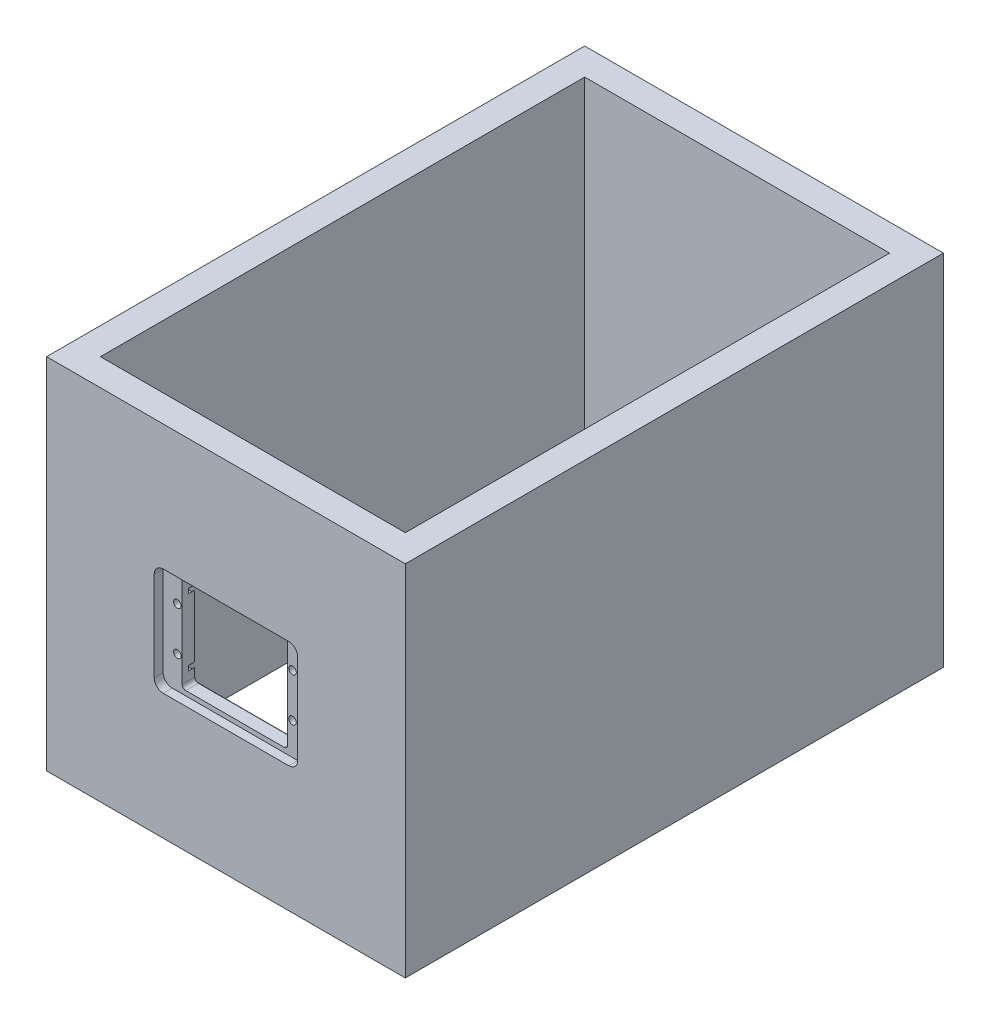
SolidWorks part; units mm, degrees
ref_plane "前基準面" through (0, 0, 0) normal (0, 0, 1) x (1, 0, 0)
ref_plane "上基準面" through (0, 0, 0) normal (0, 1, 0) x (1, 0, 0)
ref_plane "右基準面" through (0, 0, 0) normal (1, 0, 0) x (0, 0, -1)
sketch "草圖1" plane through (0, 0, 0) normal (0, 0, 1) x (1, 0, 0)
  line L1 (-100, 100) -> (100, 100)
  line L2 (-100, 100) -> (-100, -100)
  line L3 (-100, -100) -> (100, -100)
  line L4 (100, 100) -> (100, -100)
  line L5 (-100, 100) -> (100, -100) construction
  line L6 (-100, -100) -> (100, 100) construction
  point P0 (0, 0)
  dimension "D1" = 200
  dimension "D2" = 200
extrude "填料-伸長1" add sketch "草圖1" along normal blind 300
sketch "草圖2" plane through (0, -100, 0) normal (0, -1, 0) x (1, 0, 0)
  line L0 (-100, 0) -> (100, 0) construction
  line L1 (-85, 285) -> (85, 285)
  line L2 (-85, 285) -> (-85, 15)
  line L3 (-85, 15) -> (85, 15)
  line L4 (85, 285) -> (85, 15)
  line L5 (-85, 285) -> (85, 15) construction
  line L6 (-85, 15) -> (85, 285) construction
  line L7 (-100, 300) -> (100, 300) construction
  line L8 (-100, 300) -> (-100, 0) construction
  line L9 (100, 300) -> (100, 0) construction
  point P0 (0, 150)
  dimension "D1" = 15
  dimension "D2" = 15
  dimension "D3" = 15
  dimension "D4" = 15
extrude "除料-伸長1" cut sketch "草圖2" against normal through all
sketch "草圖3" plane through (0, 0, 0) normal (0, 0, -1) x (-1, 0, 0)
  circle A0 centre (0, 0) radius 7.5
  dimension "D1" = 15
extrude "除料-伸長2" cut sketch "草圖3" against normal up to next
sketch "草圖4" plane through (0, 0, 285) normal (0, 0, -1) x (-1, 0, 0)
  line L0 (0, 26.9) -> (0, -26.9) construction
  line L1 (-34.9, 26.9) -> (34.9, 26.9) construction
  line L2 (-34.9, 26.9) -> (-34.9, -26.9) construction
  line L3 (-34.9, -26.9) -> (34.9, -26.9) construction
  line L4 (34.9, 26.9) -> (34.9, -26.9) construction
  line L5 (-34.9, 26.9) -> (34.9, -26.9) construction
  line L6 (-34.9, -26.9) -> (34.9, 26.9) construction
  line L7 (34.9, 0) -> (-34.9, 0) construction
  line L8 (27.4, 27.4) -> (-27.4, 27.4)
  line L9 (29.4, 25.4) -> (29.4, -25.4)
  line L10 (27.4, -27.4) -> (-27.4, -27.4)
  line L11 (-29.4, 25.4) -> (-29.4, -25.4)
  line L12 (29.4, 27.4) -> (-29.4, -27.4) construction
  line L13 (29.4, -27.4) -> (-29.4, 27.4) construction
  circle A0 centre (21.9, 19.4) radius 4 construction
  circle A1 centre (-21.9, 19.4) radius 4 construction
  circle A2 centre (21.9, -19.4) radius 4 construction
  arc A3 (29.4, -25.4) -> (27.4, -27.4) centre (27.4, -25.4) cw
  arc A4 (-27.4, -27.4) -> (-29.4, -25.4) centre (-27.4, -25.4) cw
  arc A5 (-27.4, 27.4) -> (-29.4, 25.4) centre (-27.4, 25.4) ccw
  arc A6 (27.4, 27.4) -> (29.4, 25.4) centre (27.4, 25.4) cw
  circle A7 centre (-32.1, 12.1) radius 2.1
  circle A8 centre (32.1, 12.1) radius 2.1
  circle A9 centre (32.1, -12.1) radius 2.1
  circle A10 centre (-32.1, -12.1) radius 2.1
  point P0 (0, 0)
  point P12 (0, 0)
  dimension "D3" = 8
  dimension "D8" = 2
  dimension "D11" = 4.2
  dimension "D1" = 69.8
  dimension "D2" = 53.8
  dimension "D4" = 13
  dimension "D5" = 7.5
  dimension "D6" = 8
  dimension "D7" = 7.5
  dimension "D9" = 2.8
  dimension "D10" = 14.8
  dimension "D12" = 58.8
  dimension "D13" = 54.8
extrude "除料-伸長3" cut sketch "草圖4" against normal up to next
sketch "草圖5" plane through (0, 0, 300) normal (0, 0, 1) x (1, 0, 0)
  line L1 (-35, 30) -> (35, 30)
  line L2 (-40, 25) -> (-40, -25)
  line L3 (-35, -30) -> (35, -30)
  line L4 (40, 25) -> (40, -25)
  line L5 (-40, 30) -> (40, -30) construction
  line L6 (-40, -30) -> (40, 30) construction
  arc A0 (-40, -25) -> (-35, -30) centre (-35, -25) ccw
  arc A1 (35, -30) -> (40, -25) centre (35, -25) ccw
  arc A2 (35, 30) -> (40, 25) centre (35, 25) cw
  arc A3 (-35, 30) -> (-40, 25) centre (-35, 25) ccw
  point P0 (0, 0)
  dimension "D3" = 5
  dimension "D1" = 80
  dimension "D2" = 60
extrude "除料-伸長4" cut sketch "草圖5" against normal blind 5
sketch "草圖6" plane through (0, 0, 285) normal (0, 0, -1) x (-1, 0, 0)
  line L1 (-33.25, 30.25) -> (33.25, 30.25)
  line L2 (-38.25, 25.25) -> (-38.25, -25.25)
  line L3 (-33.25, -30.25) -> (33.25, -30.25)
  line L4 (38.25, 25.25) -> (38.25, -25.25)
  line L5 (-38.25, 30.25) -> (38.25, -30.25) construction
  line L6 (-38.25, -30.25) -> (38.25, 30.25) construction
  arc A0 (-38.25, -25.25) -> (-33.25, -30.25) centre (-33.25, -25.25) ccw
  arc A1 (33.25, -30.25) -> (38.25, -25.25) centre (33.25, -25.25) ccw
  arc A2 (33.25, 30.25) -> (38.25, 25.25) centre (33.25, 25.25) cw
  arc A3 (-33.25, 30.25) -> (-38.25, 25.25) centre (-33.25, 25.25) ccw
  point P0 (0, 0)
  dimension "D3" = 5
  dimension "D1" = 76.5
  dimension "D2" = 60.5
extrude "除料-伸長5" cut sketch "草圖6" against normal blind 3
sketch "草圖7" plane through (0, 0, 288) normal (0, 0, -1) x (-1, 0, 0)
  line L0 (38.25, -25.25) -> (38.25, 25.25) construction
  line L1 (-33.25, -30.25) -> (33.25, -30.25) construction
  line L2 (-38.25, 25.25) -> (-38.25, -25.25) construction
  line L3 (33.25, 30.25) -> (-33.25, 30.25) construction
  line L4 (38.25, -25.25) -> (38.25, 25.25) construction
  line L5 (-33.25, -30.25) -> (33.25, -30.25) construction
  line L6 (-38.25, 25.25) -> (-38.25, -25.25) construction
  line L7 (33.25, 30.25) -> (-33.25, 30.25) construction
  line L8 (0, 42.4952) -> (0, -47.2533) construction
  line L9 (-57.5161, 0) -> (70.029, 0) construction
  arc A0 (38.25, 25.25) -> (33.25, 30.25) centre (33.25, 25.25) ccw construction
  arc A1 (33.25, -30.25) -> (38.25, -25.25) centre (33.25, -25.25) ccw construction
  arc A2 (-38.25, -25.25) -> (-33.25, -30.25) centre (-33.25, -25.25) ccw construction
  arc A3 (-33.25, 30.25) -> (-38.25, 25.25) centre (-33.25, 25.25) ccw construction
  circle A4 centre (32.1, -12.1) radius 2.1 construction
  circle A5 centre (32.1, 12.1) radius 2.1 construction
  circle A6 centre (-32.1, -12.1) radius 2.1 construction
  circle A7 centre (-32.1, 12.1) radius 2.1 construction
  arc A8 (38.25, 25.25) -> (33.25, 30.25) centre (33.25, 25.25) ccw construction
  arc A9 (33.25, -30.25) -> (38.25, -25.25) centre (33.25, -25.25) ccw construction
  arc A10 (-38.25, -25.25) -> (-33.25, -30.25) centre (-33.25, -25.25) ccw construction
  arc A11 (-33.25, 30.25) -> (-38.25, 25.25) centre (-33.25, 25.25) ccw construction
  circle A12 centre (32.1, -12.1) radius 2.1 construction
  circle A13 centre (32.1, 12.1) radius 2.1 construction
  circle A14 centre (-32.1, -12.1) radius 2.1 construction
  circle A15 centre (-32.1, 12.1) radius 2.1 construction
  circle A16 centre (-32.1, 19.4) radius 3
  circle A17 centre (-32.1, -19.4) radius 3
  circle A18 centre (32.1, 17.9) radius 3
  circle A19 centre (32.1, -19.4) radius 3
  dimension "D1" = 6
  dimension "D4" = 6
  dimension "D2" = 7.3
  dimension "D3" = 5.8
extrude "除料-伸長6" cut sketch "草圖7" against normal blind 3.5 contours A16 M25 | A19 M29 | A17 | A18
